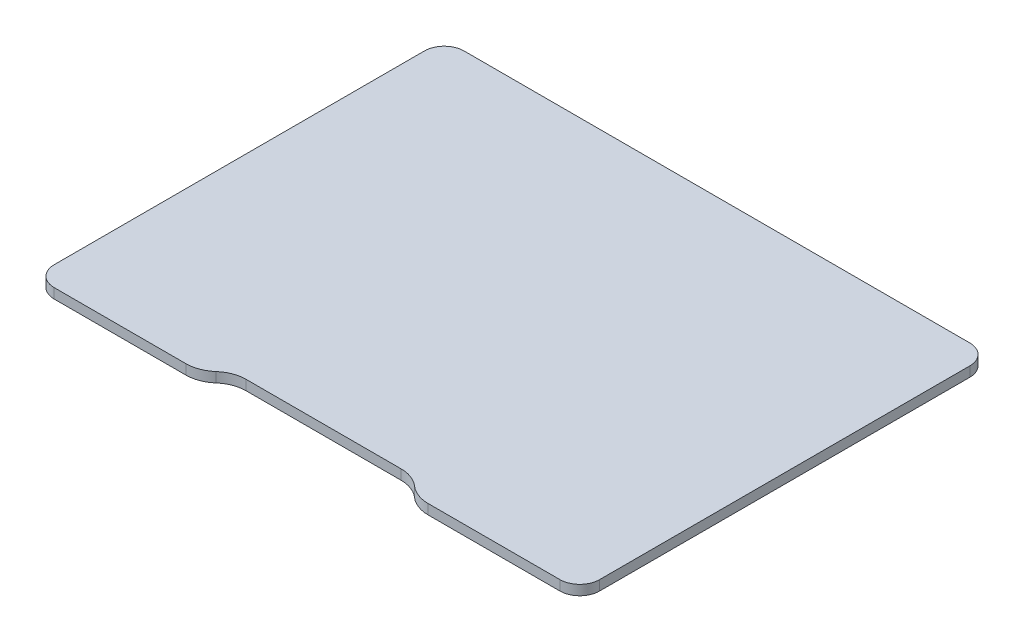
SolidWorks part; units mm, degrees
ref_plane "Front Plane" through (0, 0, 0) normal (0, 0, 1) x (1, 0, 0)
ref_plane "Top Plane" through (0, 0, 0) normal (0, 1, 0) x (1, 0, 0)
ref_plane "Right Plane" through (0, 0, 0) normal (1, 0, 0) x (0, 0, -1)
sketch "Sketch1" plane through (0, 0, 0) normal (0, 1, 0) x (1, 0, 0)
  line L0 (-32.5, -62) -> (-27.5, -57)
  line L1 (82.5, -62) -> (32.5, -62)
  line L2 (82.5, -62) -> (82.5, 62)
  line L3 (82.5, 62) -> (-82.5, 62)
  line L4 (-82.5, -62) -> (-82.5, 62)
  line L5 (82.5, -62) -> (-82.5, 62) construction
  line L6 (82.5, 62) -> (-82.5, -62) construction
  line L7 (-27.5, -57) -> (27.5, -57)
  line L8 (27.5, -57) -> (32.5, -62)
  line L9 (-32.5, -62) -> (-82.5, -62)
  line L10 (-32.5, -62) -> (-27.5, -62) construction
  line L11 (-27.5, -62) -> (-27.5, -57) construction
  line L12 (32.5, -62) -> (27.5, -62) construction
  line L13 (27.5, -62) -> (27.5, -57) construction
  line L14 (-27.5, -62) -> (27.5, -62) construction
  point P0 (0, 0)
  point P8 (0, -57)
  dimension "D1" = 165
  dimension "D2" = 124
  dimension "D3" = 5
  dimension "D4" = 45
  dimension "D5" = 55
extrude "Boss-Extrude1" add sketch "Sketch1" along normal blind 3
fillet "Fillet1" radius 6 4 edges at (-82.5, 1.5, -62) (82.5, 1.5, -62) (-82.5, 1.5, 62) (82.5, 1.5, 62)
fillet "Fillet2" radius 10 2 edges at (32.5, 1.5, 62) (-32.5, 1.5, 62)
fillet "Fillet3" radius 10 2 edges at (-27.5, 1.5, 57) (27.5, 1.5, 57)
